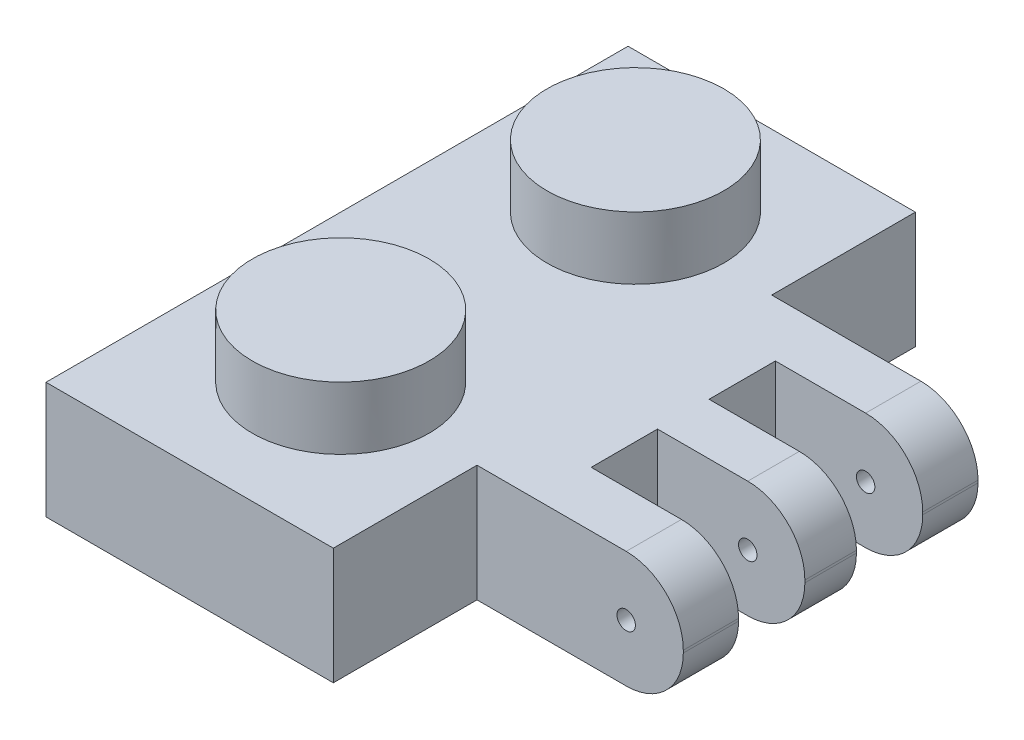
SolidWorks part; units mm, degrees
ref_plane "Front Plane" through (0, 0, 0) normal (0, 0, 1) x (1, 0, 0)
ref_plane "Top Plane" through (0, 0, 0) normal (0, 1, 0) x (1, 0, 0)
ref_plane "Right Plane" through (0, 0, 0) normal (1, 0, 0) x (0, 0, -1)
sketch "Sketch1" plane through (0, 0, 0) normal (0, 1, 0) x (1, 0, 0)
  line L1 (0, 0) -> (7.8, 0)
  line L2 (0, 0) -> (0, 15.8)
  line L3 (0, 15.8) -> (7.8, 15.8)
  line L4 (7.8, 0) -> (7.8, 15.8)
  dimension "D1" = 7.8
  dimension "D2" = 15.8
extrude "Extrude1" add sketch "Sketch1" along normal blind 3.166
sketch "Sketch2" plane through (0, 3.166, 0) normal (0, 1, 0) x (1, 0, 0)
  circle A0 centre (4, 4) radius 2.4
  point P6 (9.3567, 6.1688)
  dimension "D1" = 4.8
extrude "Extrude2" add sketch "Sketch2" along normal blind 1.7
sketch "Sketch3" plane through (0, 0, 0) normal (0, -1, 0) x (1, 0, 0)
  line L0 (7.8, 0) -> (7.8, -15.8) construction
  line L1 (1.45, -9.45) -> (6.35, -9.45)
  line L2 (1.45, -9.45) -> (1.45, -14.35)
  line L3 (1.45, -14.35) -> (6.35, -14.35)
  line L4 (6.35, -9.45) -> (6.35, -14.35)
  line L5 (7.8, -15.8) -> (0, -15.8) construction
  dimension "D1" = 4.9
  dimension "D2" = 1.45
  dimension "D3" = 1.45
extrude "Extrude3" cut sketch "Sketch3" against normal blind 2.5
sketch "Sketch4" plane through (0, 3.166, 0) normal (0, 1, 0) x (1, 0, 0)
  line L0 (3.9, 0) -> (3.9, 16.3566) construction
  line L1 (0, 0) -> (7.8, 0) construction
pattern_linear "LPattern1" count 2 spacing 8 along (0, 0, -1) of "Extrude2"
pattern_linear "LPattern2" count 2 spacing 8 along (0, 0, 1) of "Extrude3"
sketch "Sketch5" plane through (7.8, 0, 0) normal (1, 0, 0) x (0, 0, -1)
  line L0 (7.9, 3.166) -> (7.9, -0.1988) construction
  line L1 (0, 3.166) -> (15.8, 3.166) construction
  line L2 (0, 0) -> (15.8, 0) construction
  line L3 (3.9, 3.166) -> (11.9, 3.166)
  line L4 (3.9, 3.166) -> (3.9, 0)
  line L5 (3.9, 0) -> (11.9, 0)
  line L6 (11.9, 3.166) -> (11.9, 0)
  dimension "D1" = 8
  dimension "D2" = 4
extrude "Boss-Extrude1" add sketch "Sketch5" along normal blind 5.6
sketch "Sketch6" plane through (13.4, 0, 0) normal (1, 0, 0) x (0, 0, -1)
  line L0 (11.9, 3.166) -> (3.9, 3.166) construction
  line L5 (3.9, 0) -> (11.9, 0) construction
  line L6 (8.6, 3.166) -> (10.4, 3.166)
  line L7 (8.6, 3.166) -> (8.6, 0)
  line L8 (8.6, 0) -> (10.4, 0)
  line L9 (10.4, 3.166) -> (10.4, 0)
  line L10 (11.9, 0) -> (11.9, 3.166) construction
  dimension "D2" = 1.8
  dimension "D3" = 1.5
extrude "Cut-Extrude1" cut sketch "Sketch6" against normal blind 4
sketch "Sketch7" plane through (0, 3.166, 0) normal (0, 1, 0) x (1, 0, 0)
  line L0 (13.4, 8.6) -> (13.4, 3.9) construction
  line L1 (13.4, 7.2) -> (9.4, 7.2)
  line L2 (13.4, 7.2) -> (13.4, 5.4)
  line L3 (13.4, 5.4) -> (9.4, 5.4)
  line L4 (9.4, 7.2) -> (9.4, 5.4)
  line L5 (13.4, 3.9) -> (7.8, 3.9) construction
  dimension "D1" = 1.8
  dimension "D2" = 1.5
extrude "Cut-Extrude2" cut sketch "Sketch7" against normal through all
fillet "Fillet1" radius 1.55 6 edges at (13.4, 0, -11.15) (13.4, 3.166, -11.15) (13.4, 0, -7.9) (13.4, 3.166, -7.9) (13.4, 0, -4.65) (13.4, 3.166, -4.65)
sketch "Sketch8" plane through (0, 0, -3.9) normal (0, 0, 1) x (1, 0, 0)
  circle A0 centre (11.85, 1.55) radius 0.25
  arc A1 (11.85, 0) -> (13.4, 1.55) centre (11.85, 1.55) ccw construction
  dimension "D1" = 0.5
extrude "Cut-Extrude3" cut sketch "Sketch8" against normal through all
